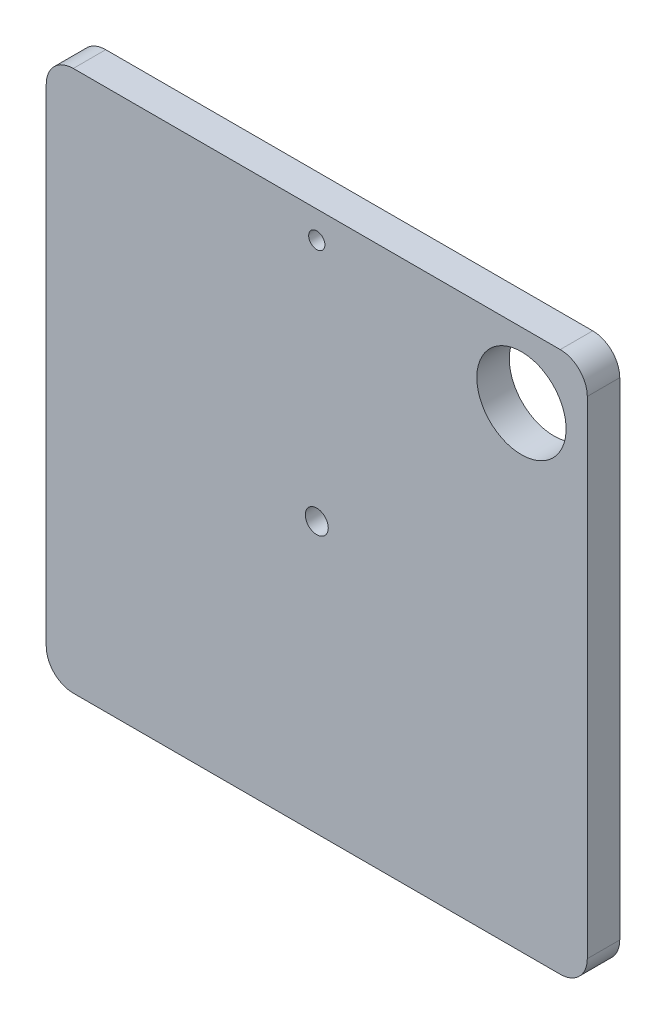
SolidWorks part; units mm, degrees
ref_plane "Plan de face" through (0, 0, 0) normal (0, 0, 1) x (1, 0, 0)
ref_plane "Plan de dessus" through (0, 0, 0) normal (0, 1, 0) x (1, 0, 0)
ref_plane "Plan de droite" through (0, 0, 0) normal (1, 0, 0) x (0, 0, -1)
sketch "Esquisse1" plane through (0, 0, 0) normal (0, 0, 1) x (1, 0, 0)
  line L0 (0, 0) -> (200, -200) construction
  line L1 (0, 0) -> (200, 0)
  line L2 (0, 0) -> (0, -200)
  line L3 (0, -200) -> (200, -200)
  line L4 (200, 0) -> (200, -200)
  line L5 (200, 0) -> (0, -200) construction
  circle A1 centre (100, -10) radius 3
  circle A2 centre (100, -100) radius 4.25
  dimension "D6" = 6
  dimension "D8" = 8.5
  dimension "D1" = 200
  dimension "D2" = 200
  dimension "D5" = 10
  dimension "D7" = 100
extrude "Boss.-Extru.2" add sketch "Esquisse1" along normal blind 12
sketch "Esquisse3" plane through (0, 0, 0) normal (0, 0, -1) x (-1, 0, 0)
  line L0 (-100, -100) -> (-200, 0) construction
  circle A0 centre (-175.6604, -24.3396) radius 16.5
  dimension "D1" = 33
  dimension "D2" = 107
extrude "Enlèv. mat.-Extru.2" cut sketch "Esquisse3" against normal through all
fillet "Congé1" radius 10 4 edges at (200, 0, 6) (0, 0, 6) (0, -200, 6) (200, -200, 6)
